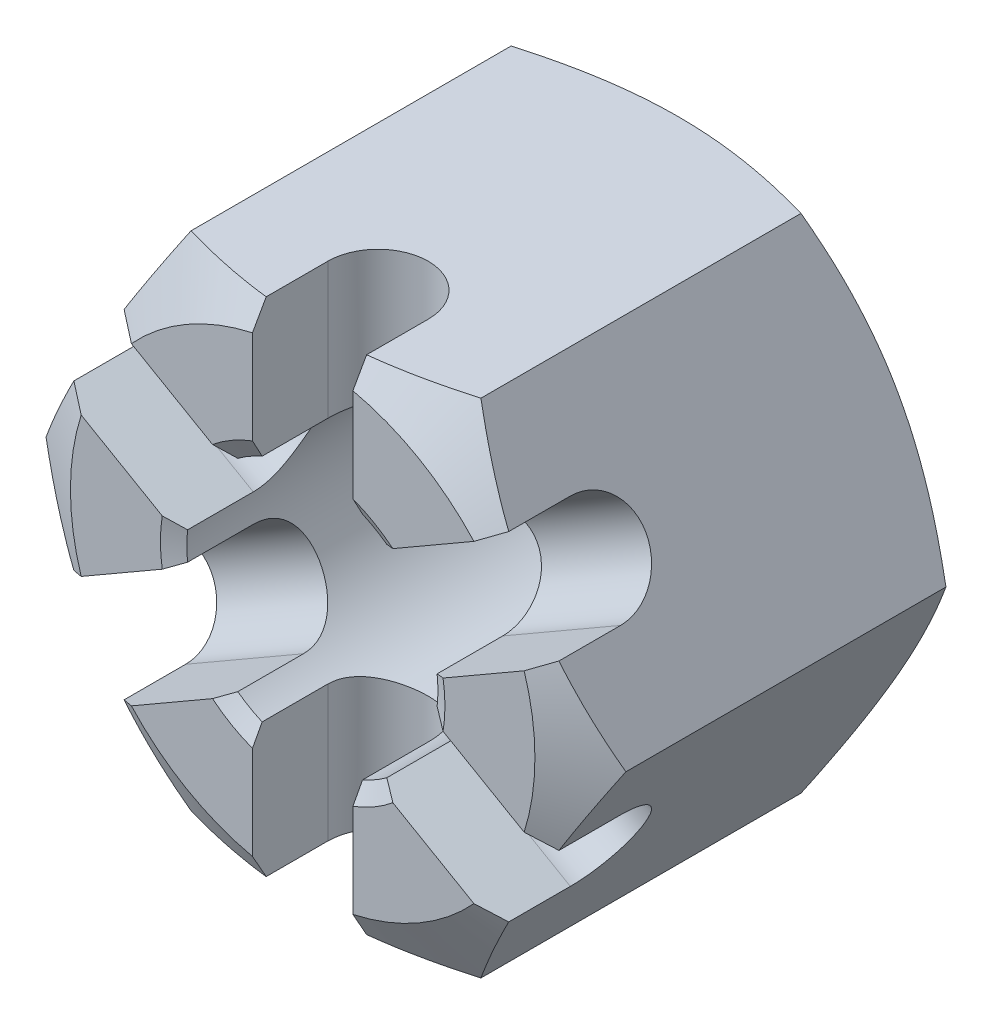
SolidWorks part; units mm, degrees
ref_plane "Front" through (0, 0, 0) normal (0, 0, 1) x (1, 0, 0)
ref_plane "Top" through (0, 0, 0) normal (0, 1, 0) x (1, 0, 0)
ref_plane "Right" through (0, 0, 0) normal (1, 0, 0) x (0, 0, -1)
sketch "Sketch1" plane through (0, 0, 0) normal (0, 0, 1) x (1, 0, 0)
  line L1 (2.8868, -5) -> (5.7735, 0)
  line L2 (5.7735, 0) -> (2.8868, 5)
  line L3 (2.8868, 5) -> (-2.8868, 5)
  line L4 (-2.8868, 5) -> (-5.7735, 0)
  line L5 (-5.7735, 0) -> (-2.8868, -5)
  line L6 (-2.8868, -5) -> (2.8868, -5)
  circle A0 centre (0, 0) radius 5 construction
  circle A1 centre (0, 0) radius 2.5
  dimension "D1" = 5
  dimension "s" = 10
extrude "BaseNut" add sketch "Sketch1" against normal blind 7.7
sketch "Sketch2" plane through (0, 0, 0) normal (0, 1, 0) x (1, 0, 0)
  line L0 (-5.7735, 7.7) -> (-4.625, 7.7)
  line L2 (-4.625, 7.7) -> (-5.7735, 7.0369)
  line L3 (-5.7735, 7.0369) -> (-5.7735, 7.7)
  line L4 (0, 3.3759) -> (0, -9.8171) construction
  line L6 (-9.7712, 3.85) -> (9.8853, 3.85) construction
  line L7 (-5.7735, 0.6631) -> (-5.7735, 0)
  line L8 (-4.625, 0) -> (-5.7735, 0.6631)
  line L9 (-5.7735, 0) -> (-4.625, 0)
  line L10 (-5.7735, 7.7) -> (-5.7735, 0) construction
  dimension "D1" = 30
  dimension "dw" = 9.25
  dimension "D2" = 3.85
revolve "Double-Chamfer" cut sketch "Sketch2" angle 360 about L4
chamfer "EndChamfer" distance 0.3333 angle 30 2 edges at (2.5, 0, -7.7) (2.5, 0, 0)
sketch "Sketch3" plane through (0, 0, 0) normal (0, 1, 0) x (1, 0, 0)
  line L0 (0, 4.2201) -> (0, -10.5237) construction
  line L2 (-1, 0) -> (-1, 1.5)
  line L3 (1, 0) -> (1, 1.5)
  line L4 (2.6925, 7.7) -> (-2.6925, 7.7) construction
  arc A0 (-1, 1.5) -> (1, 1.5) centre (0, 1.5) cw
  point P2 (0, 2.5)
  point P3 (0, 7.7)
  dimension "D1" = 2.5
  dimension "W" = 5.2
  dimension "n" = 2
extrude "Slot" cut sketch "Sketch3" against normal through all and the other way through all
ref_axis "Axis1" through (0, 0, 1.7096) along (0, 0, -1)
pattern_circular "SlotPattern" count 3 over 360 about axis through (0, 0, 1.7096) along (0, 0, -1) of "Slot"
sketch "Sketch4" plane through (0, 0, 0) normal (0, 1, 0) x (1, 0, 0)
  line L0 (4.625, 0) -> (4.625, 2.5)
  line L2 (4.625, 2.5) -> (5.7735, 3.1631)
  line L4 (4.625, 0) -> (5.7735, 0)
  line L5 (5.7735, 0) -> (5.7735, 3.1631)
  line L7 (0, -0.375) -> (0, -8.8366) construction
  line L9 (4.4106, 0) -> (4.625, 0) construction
  line L10 (5.7735, 7.0369) -> (5.7735, 0.6631) construction
  dimension "D1" = 30
  dimension "W" = 5.2
  dimension "de" = 9.25
revolve "Cut-Revolve1" [suppressed] cut sketch "Sketch4" angle 360 about L7
sketch "Sketch5" plane through (0, 0, 0) normal (0, 1, 0) x (1, 0, 0)
  line L0 (0, 9.8217) -> (0, -3.0923) construction
  line L1 (2, 7.6167) -> (2, 7.1167)
  line L2 (2, 7.1167) -> (2.5, 7.1167)
  line L3 (2.5, 7.1167) -> (2.933, 7.3667)
  line L4 (2.933, 7.3667) -> (2.5, 7.6167)
  line L5 (2.5, 7.6167) -> (2, 7.6167)
  line L6 (2.5, 7.3667) -> (-2.5, 7.3667) construction
  dimension "D1" = 0.5
  dimension "D2" = 5
revolve "Cut-Revolve10" [suppressed] cut sketch "Sketch5" angle 360 about L0
pattern_linear "LPattern10" [suppressed] count 12 spacing 0.6 along (0, 0, 1)
equation "\"dw@Sketch2\" = \"s@Sketch1\"-0.75"
equation "\"de@Sketch4\" = \"dw@Sketch2\""
equation "\"D1@Sketch3\" = \"m@BaseNut\" - \"W@Sketch3\""
equation "\"D2@Sketch2\" = \"m@BaseNut\" / 2"
equation "\"W@Sketch4\" = \"W@Sketch3\""
equation "\"D2@Sketch5\" = \"D1@Sketch1\""
equation "\"D1@Sketch5\" = (  \"D@ThreadCosmetic1\" - \"D1@Sketch1\" )  / 2"
equation "\"D3@LPattern10\" = \"D1@Sketch5\" * 1.2"
equation "\"D1@LPattern10\" = \"m@BaseNut\" / \"D3@LPattern10\" - 1"
equation "\"D1@EndChamfer\" = \"D1@Sketch1\" / 15"
